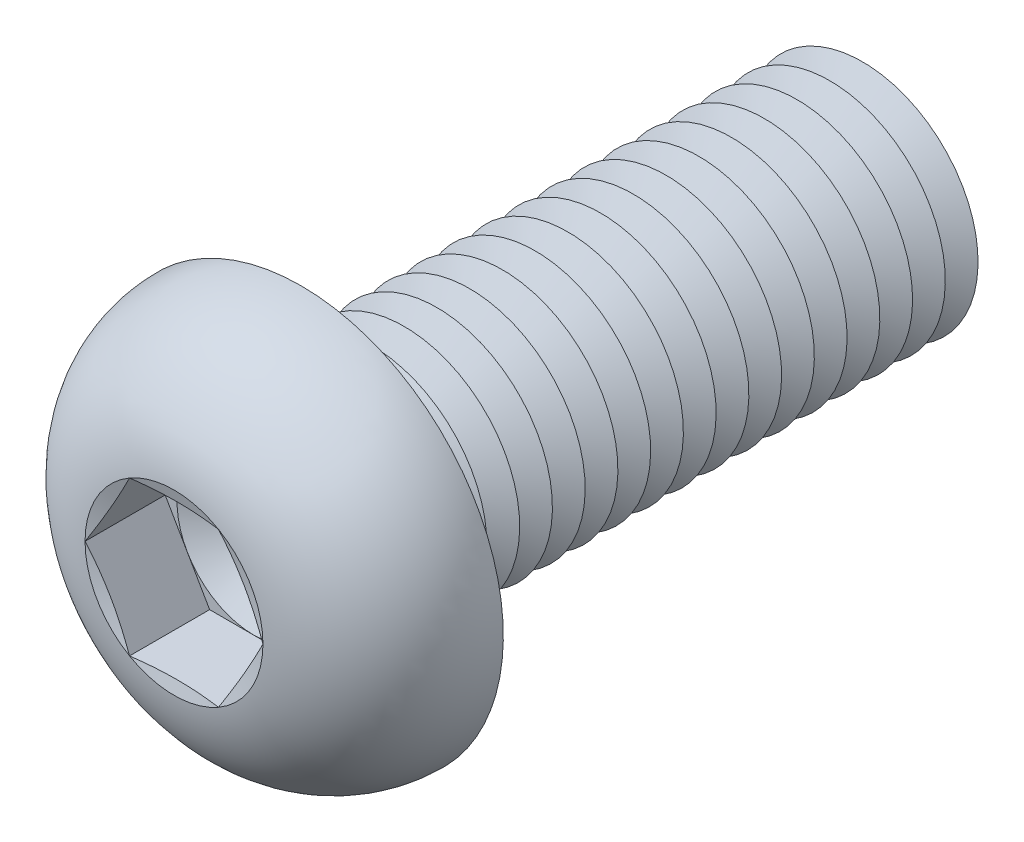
SolidWorks part; units mm, degrees
ref_plane "Front Plane" through (0, 0, 0) normal (0, 0, 1) x (1, 0, 0)
ref_plane "Top Plane" through (0, 0, 0) normal (0, 1, 0) x (1, 0, 0)
ref_plane "Right Plane" through (0, 0, 0) normal (1, 0, 0) x (0, 0, -1)
sketch "Sketch1" plane through (0, 0, 0) normal (1, 0, 0) x (0, 0, -1)
  line L0 (0, 6) -> (0, 10.5)
  line L3 (0, 6) -> (30, 6)
  line L4 (30, 6) -> (30, 0)
  line L5 (30, 0) -> (-6.6, 0) construction
  line L6 (-6.6, 0) -> (30, 0)
  line L7 (-6.6, 4.6188) -> (-6.6, 2.3094) construction
  line L8 (-6.6, 2.3094) -> (-6.6, 0)
  line L9 (-6.6, 4.6188) -> (-5.9812, 2.3094)
  line L10 (-5.9812, 2.3094) -> (-6.6, 2.3094)
  line L11 (30, 0) -> (22.7481, 0) construction
  line L12 (0, 10.5) -> (-6.6, 10.5) construction
  arc A1 (0, 10.5) -> (-6.6, 4.6188) centre (0, 3.8561) ccw
  point P8 (30, 3)
  dimension "D1" = 21
  dimension "D2" = 12
  dimension "D3" = 6.6
  dimension "D4" = 9.2376
  dimension "D5" = 30
  dimension "D6" = 15
revolve "Revolve1" add sketch "Sketch1" angle 360 about L5
fillet "Fillet1" radius 0.85 1 edges at (0, 6, 0)
sketch "Sketch2" plane through (0, 0, 0) normal (1, 0, 0) x (0, 0, -1)
  line L0 (29.15, 6) -> (30.85, 6)
  line L1 (30, 6) -> (0.85, 6) construction
  line L2 (30.85, 6) -> (30, 4.5278)
  line L3 (30, -6) -> (30, 6) construction
  line L4 (30, 4.5278) -> (29.15, 6)
  dimension "D1" = 1.7
revolve "Cut-Revolve1" cut sketch "Sketch2" angle 360 about axis through (0, 0, -30) along (0, 0, -1)
pattern_linear "LPattern1" count 17 spacing 1.7 along (0, 0, 1) of "Cut-Revolve1"
sketch "Sketch3" plane through (0, 0, 6.6) normal (0, 0, 1) x (1, 0, 0)
  line L7 (2.3094, 4) -> (-2.3094, 4)
  line L8 (-2.3094, 4) -> (-4.6188, 0)
  line L9 (-4.6188, 0) -> (-2.3094, -4)
  line L10 (-2.3094, -4) -> (2.3094, -4)
  line L11 (2.3094, -4) -> (4.6188, 0)
  line L12 (4.6188, 0) -> (2.3094, 4)
  circle A0 centre (0, 0) radius 4 construction
  circle A3 centre (0, 0) radius 4.6188 construction
extrude "Cut-Extrude1" cut sketch "Sketch3" against normal blind 4.16
sketch "Sketch4" plane through (0, 0, 2.44) normal (0, 0, 1) x (1, 0, 0)
  line L1 (2.3094, 4) -> (-2.3094, 4) construction
  circle A0 centre (0, 0) radius 4
extrude "Cut-Extrude2" cut sketch "Sketch4" against normal through all draft 60
